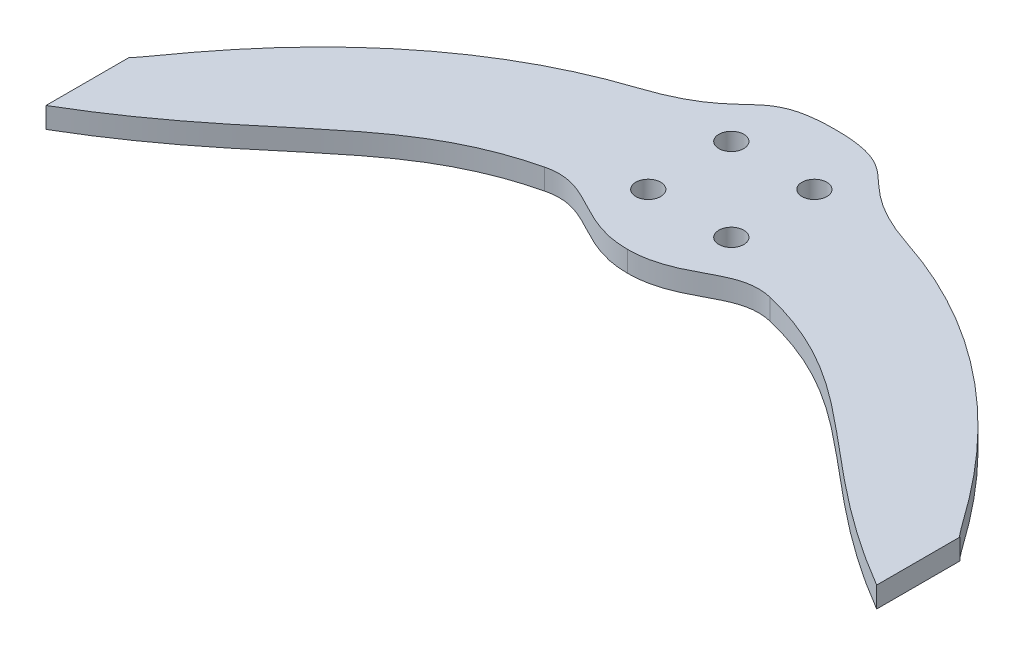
SolidWorks part; units mm, degrees
ref_plane "Front Plane" through (0, 0, 0) normal (0, 0, 1) x (1, 0, 0)
ref_plane "Top Plane" through (0, 0, 0) normal (0, 1, 0) x (1, 0, 0)
ref_plane "Right Plane" through (0, 0, 0) normal (1, 0, 0) x (0, 0, -1)
sketch "Sketch1" plane through (0, 0, 0) normal (0, 1, 0) x (1, 0, 0)
  line L0 (-50, -30) -> (-50, -40)
  line L1 (-21.1553, 0) -> (21.3043, 0) construction
  line L2 (0, 0) -> (0, -15)
  line L3 (0, -55) -> (0, 55) construction
  line L4 (27.0279, -15) -> (-27.0279, -15) construction
  line L5 (-65.4745, -39.0582) -> (-33.9373, -20.5975) construction
  line L6 (-31.6691, -29.2698) -> (-68.2485, -50.682) construction
  line L7 (-55, 0) -> (55, 0) construction
  line L8 (-12.139, -1.2159) -> (-20.434, -3.9391) construction
  line L9 (-7.6198, -14.9593) -> (-19.55, -17.8726) construction
  line L10 (5.0254, -20) -> (-5.0484, -20) construction
  line L11 (7.1555, 5) -> (-7.5983, 5) construction
  line L12 (0, 5) -> (0, 0)
  line L13 (0, -15) -> (0, -20)
  spline S0 degree 3 poles (0, 0) (-32.7343, 0) (-48.6017, -29.1815) (-50, -30) knots 0 0 0 0 1 1 1 1
  spline S1 degree 3 poles (-50, -40) (-28.1511, -27.2105) (-26.8265, -15) (0, -15) knots 0 0 0 0 1 1 1 1
  spline S2 degree 3 poles (-16.2793, -2.5752) (-5.8704, 0.842) (-9.2211, 5) (0, 5) knots 0 0 0 0 1 1 1 1
  spline S3 degree 3 poles (-13.5849, -16.416) (-8.614, -15.2021) (-6.2961, -20) (0, -20) knots 0 0 0 0 1 1 1 1
  dimension "D5" = 5
  dimension "D1" = 10
  dimension "D2" = 15
  dimension "D3" = 50
  dimension "D4" = 30
  dimension "D6" = 5
extrude "Boss-Extrude1" add sketch "Sketch1" along normal blind 2.5 contours L0 S1 L2 S0 | S2 S0 L12 | S1 S3 L13
mirror "Mirror1" about plane through (0, 0, 0) normal (1, 0, 0)
sketch "Sketch2" plane through (0, 2.5, 0) normal (0, 1, 0) x (1, 0, 0)
  line L0 (0, -1.375) -> (0, 1.375) construction
  line L1 (5, -2.5) -> (-5, -2.5) construction
  line L2 (5, -2.5) -> (5, -12.5) construction
  line L3 (5, -12.5) -> (-5, -12.5) construction
  line L4 (-5, -2.5) -> (-5, -12.5) construction
  line L5 (5, -2.5) -> (-5, -12.5) construction
  line L6 (5, -12.5) -> (-5, -2.5) construction
  circle A0 centre (-5, -2.5) radius 1.5
  circle A1 centre (-5, -12.5) radius 1.5
  circle A2 centre (5, -12.5) radius 1.5
  circle A3 centre (5, -2.5) radius 1.5
  point P0 (0, -7.5)
  dimension "D3" = 3
  dimension "D1" = 10
  dimension "D2" = 2.5
extrude "Cut-Extrude2" cut sketch "Sketch2" against normal through all
